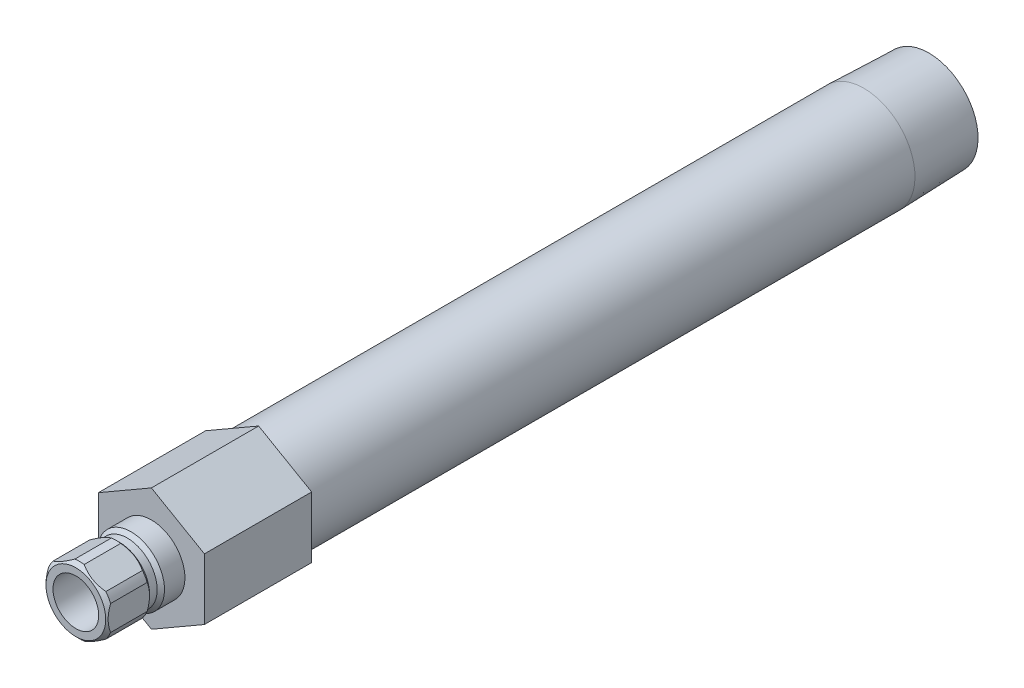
SolidWorks part; units mm, degrees
ref_plane "Front Plane" through (0, 0, 0) normal (0, 0, 1) x (1, 0, 0)
ref_plane "Top Plane" through (0, 0, 0) normal (0, 1, 0) x (1, 0, 0)
ref_plane "Right Plane" through (0, 0, 0) normal (1, 0, 0) x (0, 0, -1)
sketch "Sketch1" plane through (0, 0, 0) normal (1, 0, 0) x (0, 0, -1)
  line L0 (-13.1224, 0) -> (-18.923, 0) construction
  line L1 (-15.748, 4.7625) -> (-15.748, 6.223)
  line L2 (-6.604, 6.223) -> (-6.604, 0) construction
  line L3 (-14.986, 6.985) -> (-7.366, 6.985)
  line L5 (-6.604, 6.223) -> (-5.0165, 6.223)
  line L6 (-4.2545, 6.985) -> (0, 6.985)
  line L7 (0, 6.985) -> (0, 10.668)
  line L8 (-6.604, 6.223) -> (-7.366, 6.985)
  line L9 (-5.0165, 6.223) -> (-4.2545, 6.985)
  line L10 (-15.748, 6.223) -> (-14.986, 6.985)
  line L11 (-15.748, 4.7625) -> (22.352, 4.7625)
  line L12 (0, 10.668) -> (148.4884, 10.668)
  line L13 (148.4884, 10.668) -> (162.052, 10.2441)
  line L14 (162.052, 10.2441) -> (162.052, 7.8994)
  line L15 (0, 6.985) -> (22.352, 6.985) construction
  line L16 (22.352, 6.985) -> (22.352, 0) construction
  line L17 (22.352, 0) -> (-13.1224, 0) construction
  line L18 (22.352, 4.7625) -> (22.352, 7.8994)
  line L19 (22.352, 7.8994) -> (162.052, 7.8994)
  dimension "D1" = 15.748
  dimension "D2" = 1.5875
  dimension "D3" = 0.762
  dimension "D4" = 45
  dimension "D5" = 9.144
  dimension "D6" = 45
  dimension "D7" = 1.79
  dimension "D8" = 13.5636
  dimension "D9" = 177.8
  dimension "D10" = 3.175
  dimension "D11" = 9.525
  dimension "D12" = 21.336
  dimension "D13" = 38.1
  dimension "D14" = 13.97
  dimension "D15" = 15.7988
revolve "Revolve1" add sketch "Sketch1" angle 360 about L0
sketch "Sketch2" plane through (0, 0, 0) normal (0, 0, 1) x (1, 0, 0)
  line L1 (-11.049, 6.3791) -> (-11.049, -6.3791)
  line L2 (-11.049, -6.3791) -> (0, -12.7583)
  line L3 (0, -12.7583) -> (11.049, -6.3791)
  line L4 (11.049, -6.3791) -> (11.049, 6.3791)
  line L5 (11.049, 6.3791) -> (0, 12.7583)
  line L6 (0, 12.7583) -> (-11.049, 6.3791)
  circle A0 centre (0, 0) radius 11.049 construction
  circle A1 centre (0, 0) radius 4.7625 construction
  circle A2 centre (0, 0) radius 4.7625
  dimension "D1" = 22.098
extrude "Boss-Extrude1" add sketch "Sketch2" against normal up to vertex (22.352 mm away) from vertex at 0
sketch "Sketch3" plane through (0, 0, 0) normal (0, 0, 1) x (1, 0, 0)
  line L1 (6.477, -3.7395) -> (6.477, 3.7395)
  line L2 (6.477, 3.7395) -> (0, 7.479)
  line L3 (0, 7.479) -> (-6.477, 3.7395)
  line L4 (-6.477, 3.7395) -> (-6.477, -3.7395)
  line L5 (-6.477, -3.7395) -> (0, -7.479)
  line L6 (0, -7.479) -> (6.477, -3.7395)
  circle A0 centre (0, 0) radius 6.477 construction
  dimension "D1" = 12.954
extrude "Cut-Extrude1" cut sketch "Sketch3" along normal through all from vertex at 6.604 flip side to cut
